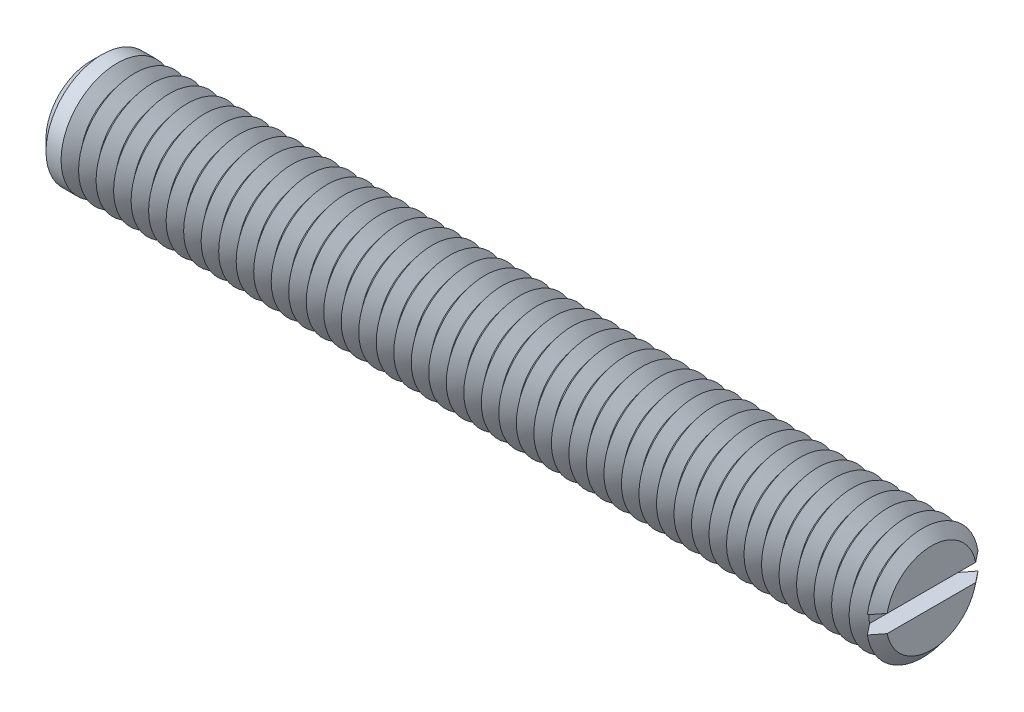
SolidWorks part; units mm, degrees
ref_plane "Front Plane" through (0, 0, 0) normal (0, 0, 1) x (1, 0, 0)
ref_plane "Top Plane" through (0, 0, 0) normal (0, 1, 0) x (1, 0, 0)
ref_plane "Right Plane" through (0, 0, 0) normal (1, 0, 0) x (0, 0, -1)
sketch "Sketch1" plane through (0, 0, 0) normal (1, 0, 0) x (0, 0, -1)
  circle A0 centre (0, 0) radius 4
  dimension "D1" = 8
extrude "Extrude1" add sketch "Sketch1" along normal mid plane 60
sketch "Sketch2" plane through (0, 0, 0) normal (0, 0, 1) x (1, 0, 0)
  line L0 (30, 0.625) -> (28.75, 0.625)
  line L1 (30, -4) -> (30, 4) construction
  line L2 (28.75, 0.625) -> (28.75, -0.625)
  line L3 (0, 0) -> (50000, 0) construction
  line L4 (30, -0.625) -> (28.75, -0.625)
  line L5 (30, -0.625) -> (30, 0.625)
  point P9 (28.75, 0)
  dimension "D1" = 1.25
extrude "Extrude2" cut sketch "Sketch2" against normal mid plane 12
chamfer "Chamfer1" distance 0.8 angle 45 1 edges at (-30, 0, -4)
sketch "Sketch3" plane through (0, 0, 0) normal (0, 0, 1) x (1, 0, 0)
  line L0 (0, 0) -> (30.9602, 0) construction
  line L1 (29.375, -4) -> (30.625, -4)
  line L2 (-29.2, -4) -> (30, -4) construction
  line L3 (30.625, -4) -> (30, -3.2194)
  line L4 (30, -4) -> (30, -0.625) construction
  line L5 (30, -3.2194) -> (29.375, -4)
  dimension "D1" = 1.25
  dimension "D2" = 1
revolve "Cut-Revolve1" cut sketch "Sketch3" angle 360 about L0
pattern_linear "LPattern1" count 47 spacing 1.25 along (-1, 0, 0) of "Cut-Revolve1"
equation "\"D2@Sketch3\" = \"D1@Sketch3\"*0.8"
